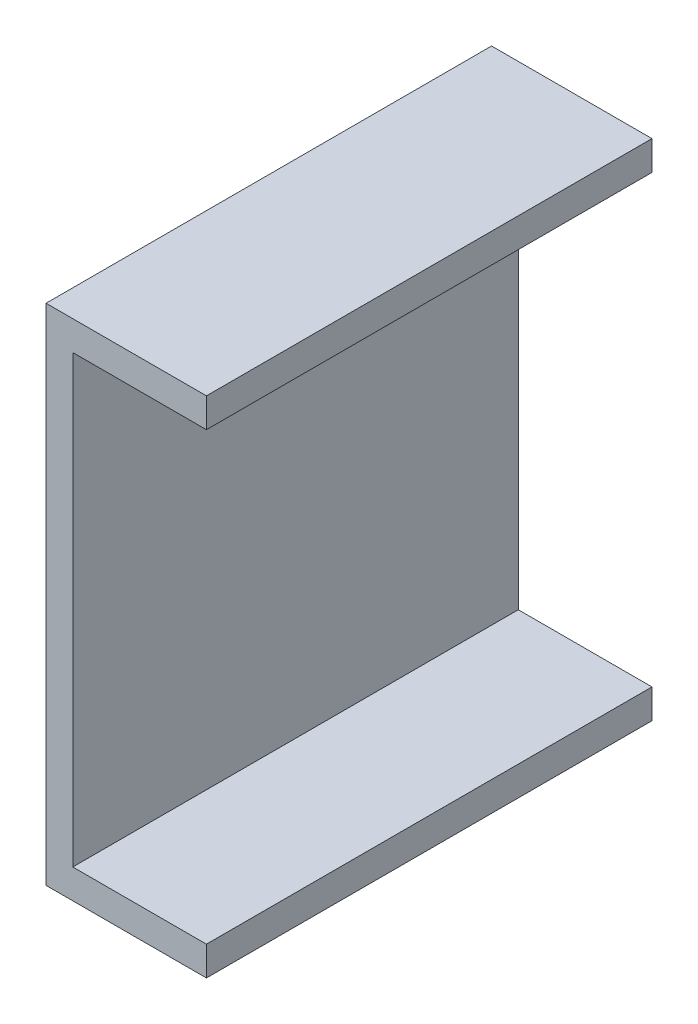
SolidWorks part; units mm, degrees
ref_plane "Front Plane" through (0, 0, 0) normal (0, 0, 1) x (1, 0, 0)
ref_plane "Top Plane" through (0, 0, 0) normal (0, 1, 0) x (1, 0, 0)
ref_plane "Right Plane" through (0, 0, 0) normal (1, 0, 0) x (0, 0, -1)
sketch "Sketch3" plane through (0, 0, 0) normal (0, 0, 1) x (1, 0, 0)
  line L1 (101.6956, 33.8979) -> (86.6956, 33.8979)
  line L2 (101.6956, 33.8979) -> (101.6956, 30.6082)
  line L3 (101.6956, 30.6082) -> (86.6956, 30.6082)
  line L5 (86.6956, 33.8979) -> (83.6956, 33.8979)
  line L6 (101.6956, -22.6818) -> (86.6956, -22.6818)
  line L7 (101.6956, -22.6818) -> (101.6956, -19.3918)
  line L8 (101.6956, -19.3918) -> (86.6956, -19.3918)
  line L10 (83.6956, 70.6082) -> (83.6956, -43.023) construction
  line L11 (83.6956, 33.8979) -> (83.6956, -22.6818)
  line L12 (83.6956, -22.6818) -> (86.6956, -22.6818)
  line L13 (86.6956, 30.6082) -> (86.6956, -19.3918)
  point P4 (85.4708, 33.8979)
  point P11 (86.6956, 30.6082)
  point P14 (83.6956, -26.3628)
  point P19 (86.6956, 1.4105)
  point P21 (93.1379, -42.6815)
  point P22 (100.6964, -24.9565)
  point P23 (0, 0)
  point P24 (86.6956, -27.5932)
  point P25 (0, 0)
  point P26 (101.6956, -24.2534)
  point P27 (86.6956, -22.6818)
  dimension "D1" = 50
  dimension "D2" = 3.29
extrude "Boss-Extrude1" add sketch "Sketch3" along normal blind 50
sketch "Sketch4" plane through (83.6956, 0, 0) normal (-1, 0, 0) x (0, 0, 1)
  line L0 (50, 33.8979) -> (0, 33.8979) construction
  line L1 (10, 33.8979) -> (-10, 33.8979)
  line L2 (10, 33.8979) -> (10, -22.6818)
  line L3 (10, -22.6818) -> (-10, -22.6818)
  line L4 (-10, 33.8979) -> (-10, -22.6818)
  line L5 (50, -22.6818) -> (0, -22.6818) construction
  line L6 (0, 33.8979) -> (0, -22.6818) construction
  point P8 (10.0939, 33.8979)
  point P9 (0, 0)
  dimension "D1" = 10
  dimension "D2" = 10
extrude "Boss-Extrude2" [suppressed] add sketch "Sketch4" along normal blind 3
